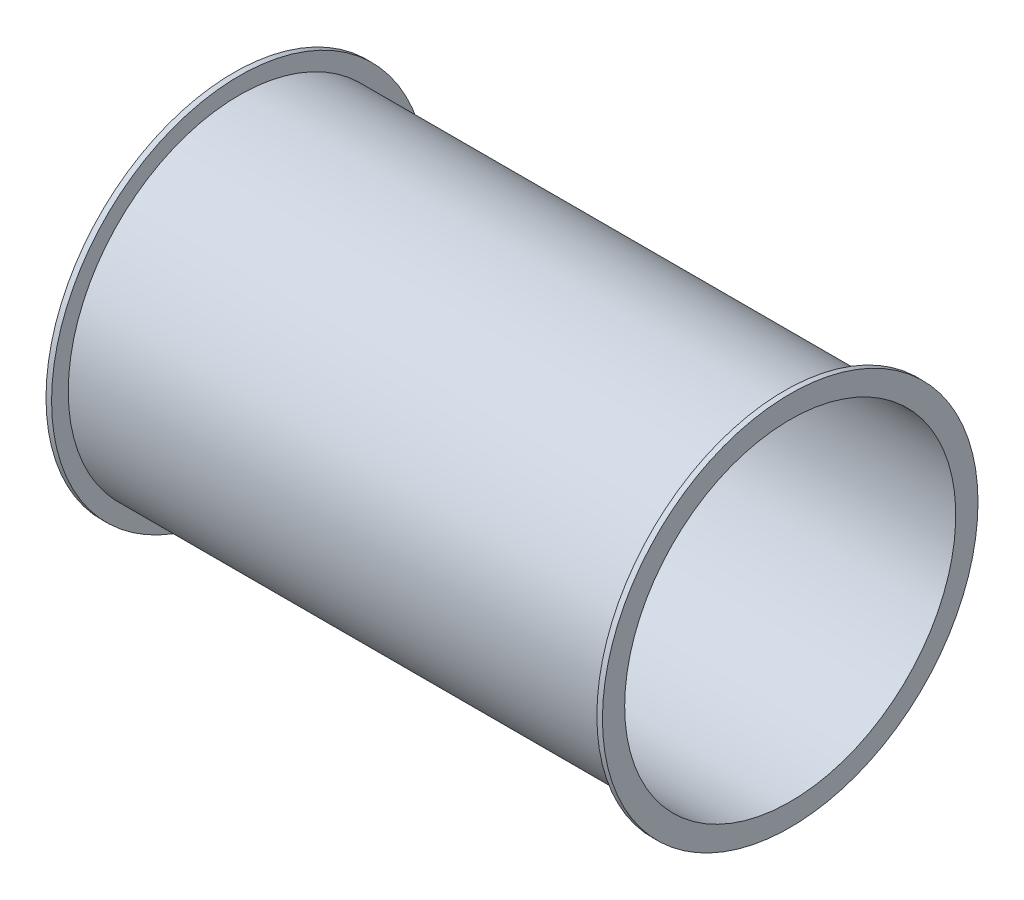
SolidWorks part; units mm, degrees
ref_plane "Front" through (0, 0, 0) normal (0, 0, 1) x (1, 0, 0)
ref_plane "Top" through (0, 0, 0) normal (0, 1, 0) x (1, 0, 0)
ref_plane "Right" through (0, 0, 0) normal (1, 0, 0) x (0, 0, -1)
sketch "Sketch1" plane through (0, 0, 0) normal (0, 0, 1) x (1, 0, 0)
  line L0 (-1176.9497, 0) -> (1154.9917, 0) construction
  line L2 (-991.709, 61.5) -> (-795.709, 61.5)
  line L3 (-993.709, 61.5) -> (-993.709, 59.5)
  line L4 (-993.709, 59.5) -> (-793.709, 59.5)
  line L5 (-793.709, 67.5) -> (-793.709, 59.5)
  line L9 (-793.709, 67.5) -> (-795.709, 67.5)
  line L10 (-795.709, 61.5) -> (-795.709, 67.5)
  line L11 (-993.709, 61.5) -> (-993.709, 67.5)
  line L12 (-993.709, 67.5) -> (-991.709, 67.5)
  line L13 (-991.709, 61.5) -> (-991.709, 67.5)
  dimension "D1" = 2
  dimension "D2" = 200
  dimension "D3" = 6
  dimension "D4" = 2
  dimension "D5" = 6
  dimension "D6" = 2
  dimension "D7" = 59.5
revolve "Revolve2" add sketch "Sketch1" angle 360 about L0
sketch "Sketch2" plane through (0, 0, 0) normal (0, 0, 1) x (1, 0, 0)
  line L0 (-993.709, 0) -> (-793.709, 0) construction
  line L1 (-1176.9497, 0) -> (1154.9917, 0) construction
  line L2 (-793.709, -67.5) -> (-793.709, 67.5) construction
  line L3 (-993.709, 67.5) -> (-993.709, -67.5) construction
equation "\"D6@Sketch1\" = \"D4@Sketch1\""
equation "\"D1@Sketch1\" = \"D4@Sketch1\""
equation "\"D5@Sketch1\" = \"D3@Sketch1\""
